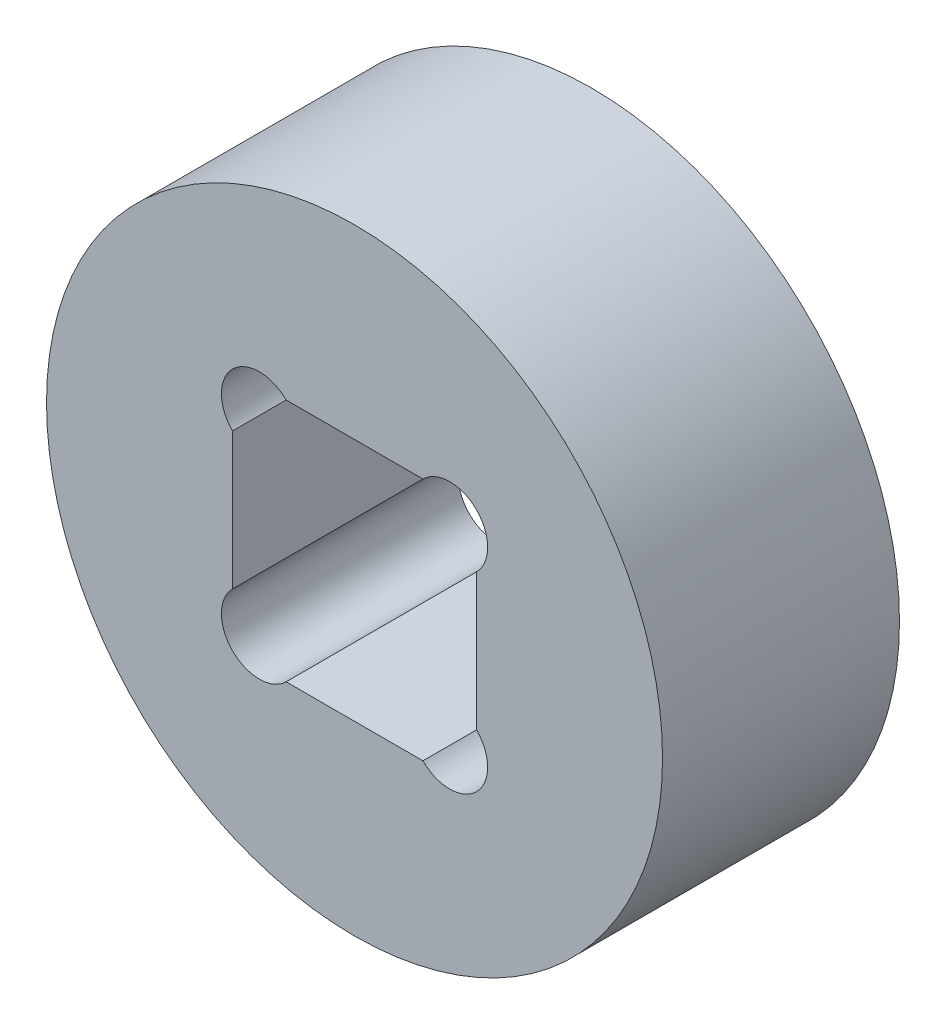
SolidWorks part; units mm, degrees
ref_plane "Plan de face" through (0, 0, 0) normal (0, 0, 1) x (1, 0, 0)
ref_plane "Plan de dessus" through (0, 0, 0) normal (0, 1, 0) x (1, 0, 0)
ref_plane "Plan de droite" through (0, 0, 0) normal (1, 0, 0) x (0, 0, -1)
sketch "Esquisse1" plane through (0, 0, 0) normal (0, 0, 1) x (1, 0, 0)
  circle A0 centre (0, 0) radius 13
extrude "Boss.-Extru.1" add sketch "Esquisse1" along normal blind 10
sketch "Esquisse2" plane through (0, 0, 10) normal (0, 0, 1) x (1, 0, 0)
  line L0 (0, -5.15) -> (0, 9.4507) construction
  line L1 (-2.8873, 5.15) -> (2.8873, 5.15)
  line L2 (-5.15, 2.8873) -> (-5.15, -2.8873)
  line L3 (-2.8873, -5.15) -> (2.8873, -5.15)
  line L4 (5.15, 2.8873) -> (5.15, -2.8873)
  line L5 (-5.15, 5.15) -> (5.15, -5.15) construction
  line L6 (-5.15, -5.15) -> (5.15, 5.15) construction
  line L7 (7.0263, 0) -> (-12.2363, 0) construction
  arc A0 (-5.15, 2.8873) -> (-2.8873, 5.15) centre (-4.0186, 4.0186) cw
  arc A1 (5.15, 2.8873) -> (2.8873, 5.15) centre (4.0186, 4.0186) ccw
  arc A2 (5.15, -2.8873) -> (2.8873, -5.15) centre (4.0186, -4.0186) cw
  arc A3 (-5.15, -2.8873) -> (-2.8873, -5.15) centre (-4.0186, -4.0186) ccw
  point P0 (0, 0)
  point P6 (-4.0186, 4.0186)
  dimension "D1" = 10.3
  dimension "D2" = 10.3
  dimension "D3" = 1.6
extrude "Enlèv. mat.-Extru.1" cut sketch "Esquisse2" against normal through all
